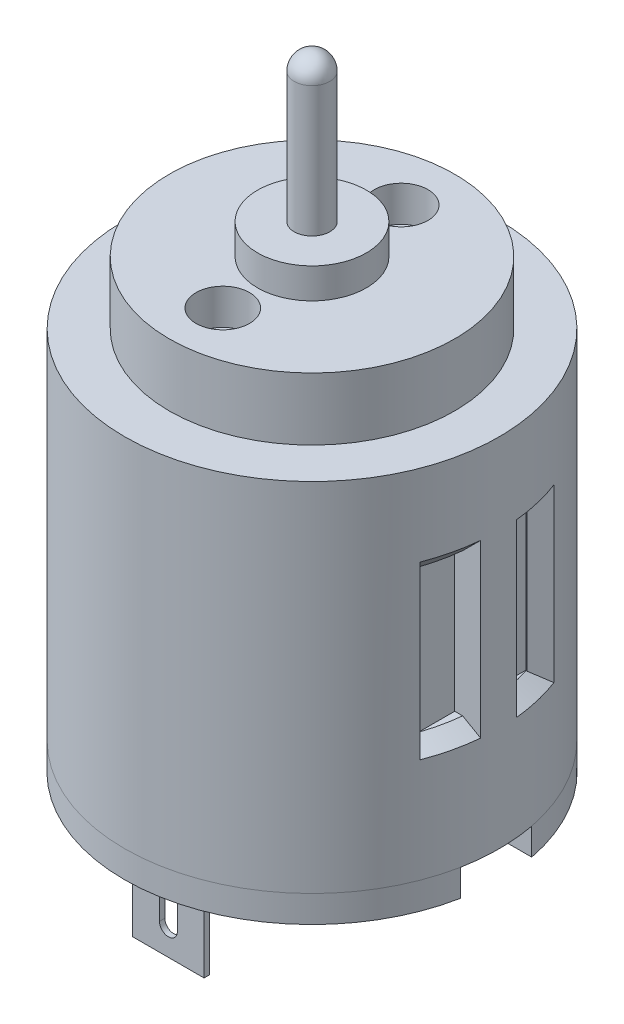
SolidWorks part; units mm, degrees
ref_plane "Front" through (0, 0, 0) normal (0, 0, 1) x (1, 0, 0)
ref_plane "Top" through (0, 0, 0) normal (0, 1, 0) x (1, 0, 0)
ref_plane "Right" through (0, 0, 0) normal (1, 0, 0) x (0, 0, -1)
sketch "Sketch1" plane through (0, 0, 0) normal (0, 1, 0) x (1, 0, 0)
  circle A0 centre (0, 0) radius 10.51
extrude "Extrude1" add sketch "Sketch1" along normal blind 1.5
sketch "Sketch2" plane through (0, 1.5, 0) normal (0, 1, 0) x (-1, 0, 0)
  circle A0 centre (0, 0) radius 10.5
extrude "Extrude2" add sketch "Sketch2" along normal blind 20
sketch "Sketch3" plane through (0, 21.5, 0) normal (0, 1, 0) x (-1, 0, 0)
  circle A0 centre (0, 0) radius 8
extrude "Extrude3" add sketch "Sketch3" along normal blind 3.5
sketch "Sketch4" plane through (0, 25, 0) normal (0, 1, 0) x (-1, 0, 0)
  circle A0 centre (0, 0) radius 3.05
extrude "Extrude4" add sketch "Sketch4" along normal blind 1.7
sketch "Sketch5" plane through (0, 26.7, 0) normal (0, 1, 0) x (-1, 0, 0)
  circle A0 centre (0, 0) radius 1
extrude "Extrude5" add sketch "Sketch5" along normal blind 8.3
sketch "Sketch6" plane through (0, 0, 0) normal (0, -1, 0) x (1, 0, 0)
  circle A0 centre (0, 0) radius 3.1
extrude "Extrude6" add sketch "Sketch6" along normal blind 3
sketch "Sketch7" plane through (0, -3, 0) normal (0, -1, 0) x (1, 0, 0)
  circle A0 centre (0, 0) radius 1.25
extrude "Cut-Extrude1" cut sketch "Sketch7" against normal blind 3
sketch "Sketch8" plane through (0, 0, 0) normal (0, -1, 0) x (1, 0, 0)
  circle A0 centre (0, 0) radius 1
extrude "Extrude7" add sketch "Sketch8" along normal blind 3
fillet "Fillet1" radius 1 1 edges at (0, -3, -1)
fillet "Fillet2" radius 1 1 edges at (0, 35, 1)
chamfer "Chamfer1" distance 1 1 edges at (0, -3, -3.1)
sketch "Sketch9" plane through (0, 25, 0) normal (0, 1, 0) x (-1, 0, 0)
  circle A1 centre (0, 5) radius 1.5
  circle A2 centre (0, -5) radius 1.5
extrude "Cut-Extrude2" cut sketch "Sketch9" against normal blind 2
sketch "Sketch10" plane through (0, 0, 0) normal (0, -1, 0) x (1, 0, 0)
  line L0 (0, 8.05) -> (5.1913, 8.05) construction
  line L1 (0, 7.75) -> (2, 7.75)
  line L2 (0, 7.75) -> (-2, 7.75)
  line L3 (0, -7.75) -> (2, -7.75)
  line L4 (0, -7.75) -> (-2, -7.75)
  line L5 (0, 8.05) -> (2, 8.05)
  line L6 (0, 8.05) -> (-2, 8.05)
  line L7 (0, -8.05) -> (-2, -8.05)
  line L8 (0, -8.05) -> (2, -8.05)
  line L9 (-2, 8.05) -> (-2, 7.75)
  line L10 (2, 8.05) -> (2, 7.75)
  line L11 (0, 7.75) -> (5.1913, 7.75) construction
  line L12 (0, -7.75) -> (6.3555, -7.75) construction
  line L13 (0, -8.05) -> (6.3555, -8.05) construction
  line L14 (0, -8.05) -> (-6.074, -8.05) construction
  line L15 (0, -7.75) -> (-6.074, -7.75) construction
  line L16 (-2, -7.75) -> (-2, -8.05)
  line L17 (2, -7.75) -> (2, -8.05)
  line L18 (0, 8.05) -> (-5.5563, 8.05) construction
  line L19 (0, 7.75) -> (-5.5563, 7.75) construction
extrude "Extrude8" add sketch "Sketch10" along normal blind 5
sketch "Sketch11" plane through (0, 0, -8.05) normal (0, 0, -1) x (-1, 0, 0)
  line L5 (-0.5, -1.5) -> (-0.5, -3.5)
  line L6 (0.5, -3.5) -> (0.5, -1.5)
  arc A0 (0.5, -1.5) -> (-0.5, -1.5) centre (0, -1.5) ccw
  arc A1 (-0.5, -3.5) -> (0.5, -3.5) centre (0, -3.5) ccw
extrude "Cut-Extrude3" cut sketch "Sketch11" against normal blind 1
sketch "Sketch12" plane through (0, 0, 8.05) normal (0, 0, 1) x (1, 0, 0)
  line L0 (-0.5, -3.5) -> (-0.5, -1.5)
  line L3 (0.5, -1.5) -> (0.5, -3.5)
  arc A0 (-0.5, -3.5) -> (0.5, -3.5) centre (0, -3.5) ccw
  arc A1 (0.5, -1.5) -> (-0.5, -1.5) centre (0, -1.5) ccw
extrude "Cut-Extrude4" cut sketch "Sketch12" against normal blind 1
sketch "Sketch13" plane through (0, 0, 0) normal (1, 0, 0) x (0, 0, -1)
  line L0 (-3, 15.9442) -> (-1, 15.9442)
  line L1 (3, 7.9232) -> (1, 7.9232)
  line L2 (-3, 25) -> (-3, 0) construction
  line L4 (-1, 15.9442) -> (-1, 7.9232)
  line L5 (1, 15.9442) -> (1, 7.9232)
  line L6 (-3, 15.9442) -> (-3, 7.9232)
  line L7 (3, 15.9442) -> (3, 7.9232)
  line L8 (-1, 25) -> (-1, 0) construction
  line L9 (1, 25) -> (1, 0) construction
  line L10 (3, 25) -> (3, 0) construction
  line L11 (1, 15.9442) -> (3, 15.9442)
  line L12 (-1, 7.9232) -> (-3, 7.9232)
extrude "Cut-Extrude5" cut sketch "Sketch13" against normal mid plane 31
sketch "Sketch14" plane through (0, 0, 0) normal (1, 0, 0) x (0, 0, -1)
  line L1 (-4.525, 17.244) -> (4.7696, 17.244)
  line L2 (-4.525, 17.244) -> (-4.525, 6.7264)
  line L3 (-4.525, 6.7264) -> (4.7696, 6.7264)
  line L4 (4.7696, 17.244) -> (4.7696, 6.7264)
extrude "Extrude9" add sketch "Sketch14" along normal mid plane 18
chamfer "Chamfer2" distance 1 angle 45 2 edges at (10.3059, 15.9442, 2.0095) (10.3059, 15.9442, -2.0095)
chamfer "Chamfer3" distance 1 angle 45 2 edges at (-10.3059, 15.9442, -2.0095) (-10.3059, 15.9442, 2.0095)
chamfer "Chamfer4" distance 1 angle 30 2 edges at (-10.3059, 7.9232, -2.0095) (-10.3059, 7.9232, 2.0095)
chamfer "Chamfer5" distance 1 angle 30 2 edges at (10.3059, 7.9232, 2.0095) (10.3059, 7.9232, -2.0095)
chamfer "Chamfer6" distance 1 angle 45 2 edges at (10.0623, 12.145, 3) (10.0623, 12.145, -3)
chamfer "Chamfer7" distance 1 angle 45 2 edges at (-10.0623, 12.145, -3) (-10.0623, 12.145, 3)
sketch "Sketch15" plane through (0, 0, 0) normal (0, -1, 0) x (1, 0, 0)
  line L1 (-8.01, 2) -> (-17.5837, 2)
  line L2 (-8.01, -2) -> (-19.2932, -2)
  line L3 (8.01, 2) -> (16.9737, 2)
  line L4 (8.01, -2) -> (18.3307, -2)
  line L5 (18.3307, -2) -> (16.9737, 2)
  line L6 (-19.2932, -2) -> (-17.5837, 2)
  arc A3 (-8.01, -2) -> (-8.01, 2) centre (-8.01, 0) ccw
  arc A4 (8.01, 2) -> (8.01, -2) centre (8.01, 0) ccw
extrude "Cut-Extrude6" cut sketch "Sketch15" against normal blind 1.5
